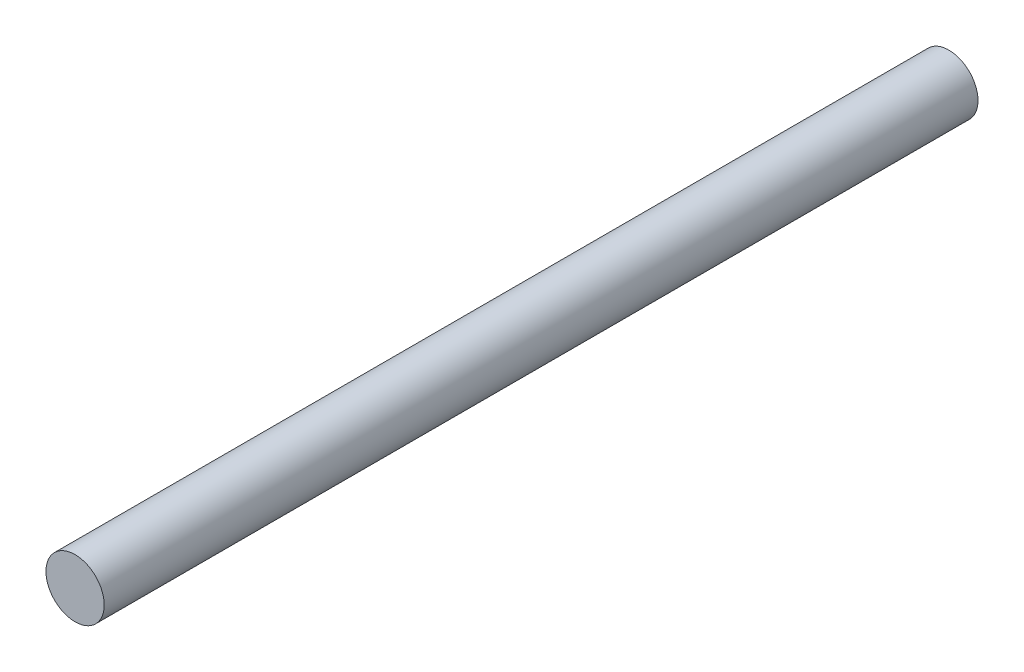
SolidWorks part; units mm, degrees
ref_plane "Alzado" through (0, 0, 0) normal (0, 0, 1) x (1, 0, 0)
ref_plane "Planta" through (0, 0, 0) normal (0, 1, 0) x (1, 0, 0)
ref_plane "Vista lateral" through (0, 0, 0) normal (1, 0, 0) x (0, 0, -1)
sketch "Croquis1" plane through (0, 0, 0) normal (0, 0, 1) x (1, 0, 0)
  circle A0 centre (0, 0) radius 0.5
  dimension "D1" = 1
extrude "Saliente-Extruir1" add sketch "Croquis1" along normal blind 15
